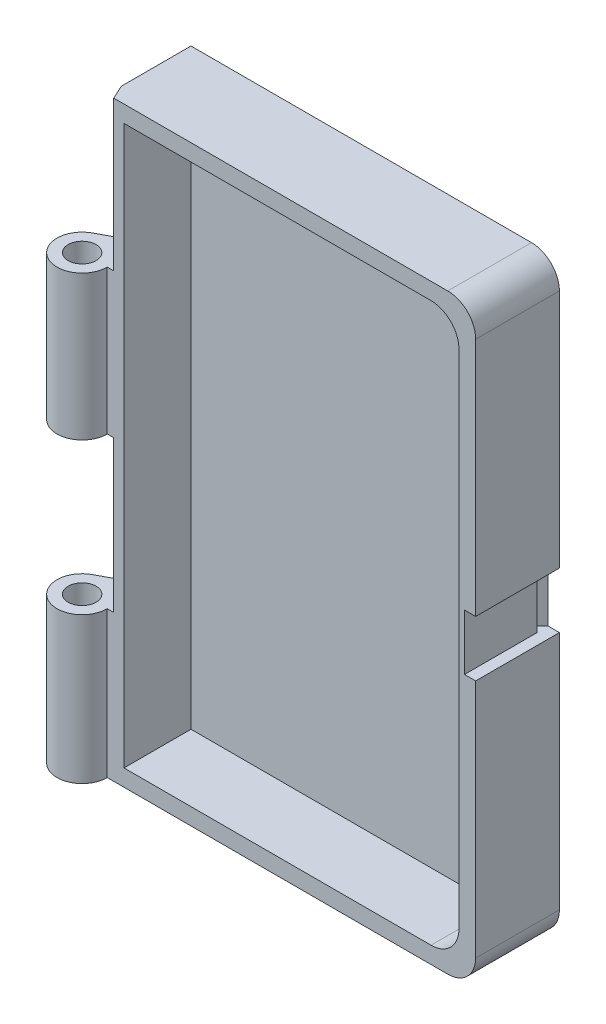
SolidWorks part; units mm, degrees
ref_plane "Plan de face" through (0, 0, 0) normal (0, 0, 1) x (1, 0, 0)
ref_plane "Plan de dessus" through (0, 0, 0) normal (0, 1, 0) x (1, 0, 0)
ref_plane "Plan de droite" through (0, 0, 0) normal (1, 0, 0) x (0, 0, -1)
sketch "Esquisse2" plane through (0, 0, 0) normal (0, 0, 1) x (1, 0, 0)
  line L0 (-33, -53) -> (-33, 53)
  line L1 (-30, -50) -> (30, -50) construction
  line L2 (-30, -50) -> (-30, 50) construction
  line L3 (-30, 50) -> (30, 50) construction
  line L4 (30, -50) -> (30, 50) construction
  line L5 (-30, -50) -> (30, 50) construction
  line L6 (-30, 50) -> (30, -50) construction
  line L7 (-33, 53) -> (33, 53)
  line L8 (33, -53) -> (33, 53)
  line L9 (-33, -53) -> (33, -53)
  point P0 (0, 0)
  dimension "D1" = 100
  dimension "D2" = 60
  dimension "D3" = 3
extrude "Boss.-Extru.2" add sketch "Esquisse2" along normal blind 15
shell "Coque1" thickness 3
sketch "Esquisse3" plane through (0, -53, 0) normal (0, -1, 0) x (1, 0, 0)
  line L0 (-33, 15) -> (-33, 7.5)
  line L1 (-39.6176, 11.0294) -> (-33, 7.5)
  line L2 (-33, 15) -> (-33, 0) construction
  circle A0 centre (-37.5, 15) radius 2.5
  arc A1 (-39.6176, 11.0294) -> (-33, 15) centre (-37.5, 15) cw
  dimension "D1" = 5
  dimension "D3" = 2
extrude "Boss.-Extru.3" add sketch "Esquisse3" against normal through all
sketch "Esquisse4" plane through (0, 0, 0) normal (0, 0, -1) x (-1, 0, 0)
  line L11 (33, 53) -> (33, 26.5) construction
  line L12 (33, 53) -> (33, -53) construction
  line L13 (33, 26.5) -> (33, 0) construction
  line L14 (33, 53) -> (33, -53) construction
  line L15 (33, 0) -> (33, -26.5) construction
  line L16 (33, -26.5) -> (33, -53) construction
  line L17 (42, -53) -> (42, 53) construction
  line L18 (33, 53) -> (42, 53)
  line L19 (33, 53) -> (33, 26.2)
  line L20 (33, 26.2) -> (42, 26.2)
  line L21 (42, 53) -> (42, 26.2)
  line L23 (33, 0.3) -> (42, 0.3)
  line L24 (33, 0.3) -> (33, -26.8)
  line L25 (33, -26.8) -> (42, -26.8)
  line L26 (42, 0.3) -> (42, -26.8)
  dimension "D1" = 0.3
  dimension "D2" = 0.3
  dimension "D3" = 0.3
extrude "Enlèv. mat.-Extru.1" cut sketch "Esquisse4" against normal through all
ref_plane "Plan1" through (0, 0, 0) normal (0, -1, 0) x (-1, 0, 0)
sketch "Esquisse6" plane through (0, 0, 0) normal (0, -1, 0) x (-1, 0, 0)
  line L2 (-31, 0) -> (-29, -2)
  line L5 (-33, -15) -> (-31, -15)
  line L8 (-31, -15) -> (-31, -2)
  line L9 (33, 0) -> (-33, 0) construction
  line L10 (-31, 0) -> (-33, 0)
  line L12 (-33, 0) -> (-33, -15)
  line L13 (-29, -2) -> (-31, -2)
  dimension "D1" = 2
  dimension "D2" = 2
  dimension "D3" = 2
extrude "Enlèv. mat.-Extru.3" cut sketch "Esquisse6" against normal mid plane 10 contours L2 L13 L8 L5 L12 L10
fillet "Congé1" radius 5 4 edges at (33, 53, 7.5) (30, 50, 9) (33, -53, 7.5) (30, -50, 9)
chamfer "Chanfrein1" distance 2.5 angle 25 1 edges at (-33, -13.25, 15)
chamfer "Chanfrein2" distance 2.5 angle 25 1 edges at (-33, 39.6, 15)
